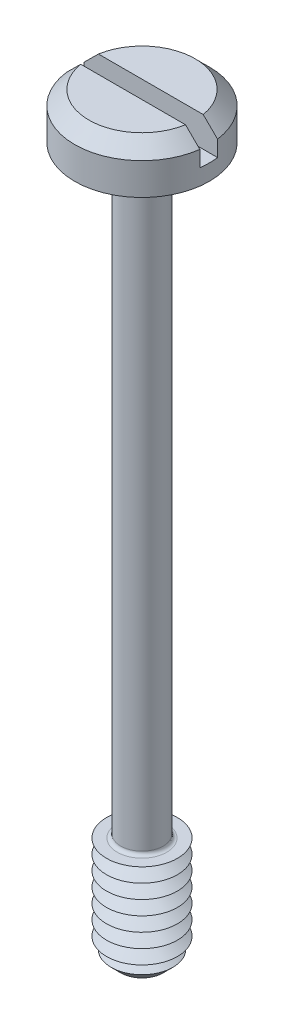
SolidWorks part; units mm, degrees
ref_plane "Front Plane" through (0, 0, 0) normal (0, 0, 1) x (1, 0, 0)
ref_plane "Top Plane" through (0, 0, 0) normal (0, 1, 0) x (1, 0, 0)
ref_plane "Right Plane" through (0, 0, 0) normal (1, 0, 0) x (0, 0, -1)
sketch "Sketch1" plane through (0, 0, 0) normal (0, 1, 0) x (1, 0, 0)
  circle A0 centre (0, 0) radius 1.9
  dimension "D1" = 3.8
extrude "Boss-Extrude1" add sketch "Sketch1" along normal blind 1.3
sketch "Sketch2" plane through (0, 0, 0) normal (0, -1, 0) x (1, 0, 0)
  circle A0 centre (0, 0) radius 0.6
  dimension "D1" = 1.2
extrude "Boss-Extrude2" add sketch "Sketch2" along normal blind 20
sketch "Sketch3" plane through (0, -20, 0) normal (0, -1, 0) x (1, 0, 0)
  circle A0 centre (0, 0) radius 1
  dimension "D1" = 2
extrude "Boss-Extrude3" add sketch "Sketch3" against normal blind 3
chamfer "Chamfer1" distance 0.4 angle 45 1 edges at (0, -20, -1)
sketch "Sketch4" plane through (0, 0, 0) normal (1, 0, 0) x (0, 0, -1)
  line L0 (0, -6.5871) -> (0, -12.0372) construction
sketch "Sketch5" plane through (0, 0, 0) normal (1, 0, 0) x (0, 0, -1)
  line L0 (-1, -17) -> (-0.6536, -17.2)
  line L1 (-0.6536, -17.2) -> (-1, -17.4)
  line L2 (-1, -17) -> (-1, -19.6) construction
  line L3 (-1, -17.4) -> (-1, -17)
  dimension "D1" = 0.4
revolve "Cut-Revolve1" cut sketch "Sketch5" angle 360 about L0
pattern_linear "LPattern1" count 7 spacing 0.4 along (0, -1, 0) of "Cut-Revolve1"
fillet "Fillet1" radius 0.1 2 edges at (0, -17, -0.6) (0, 0, -0.6)
chamfer "Chamfer2" distance 0.4 angle 45 1 edges at (0, 1.3, 1.9)
sketch "Sketch6" plane through (0, 1.3, 0) normal (0, 1, 0) x (1, 0, 0)
  line L1 (1.9, -0.25) -> (-1.9, -0.25)
  line L2 (1.9, -0.25) -> (1.9, 0.25)
  line L3 (1.9, 0.25) -> (-1.9, 0.25)
  line L4 (-1.9, -0.25) -> (-1.9, 0.25)
  line L5 (1.9, -0.25) -> (-1.9, 0.25) construction
  line L6 (1.9, 0.25) -> (-1.9, -0.25) construction
  circle A0 centre (0, 0) radius 1.9 construction
  point P0 (0, 0)
  dimension "D1" = 0.5
extrude "Cut-Extrude1" cut sketch "Sketch6" against normal blind 0.85
